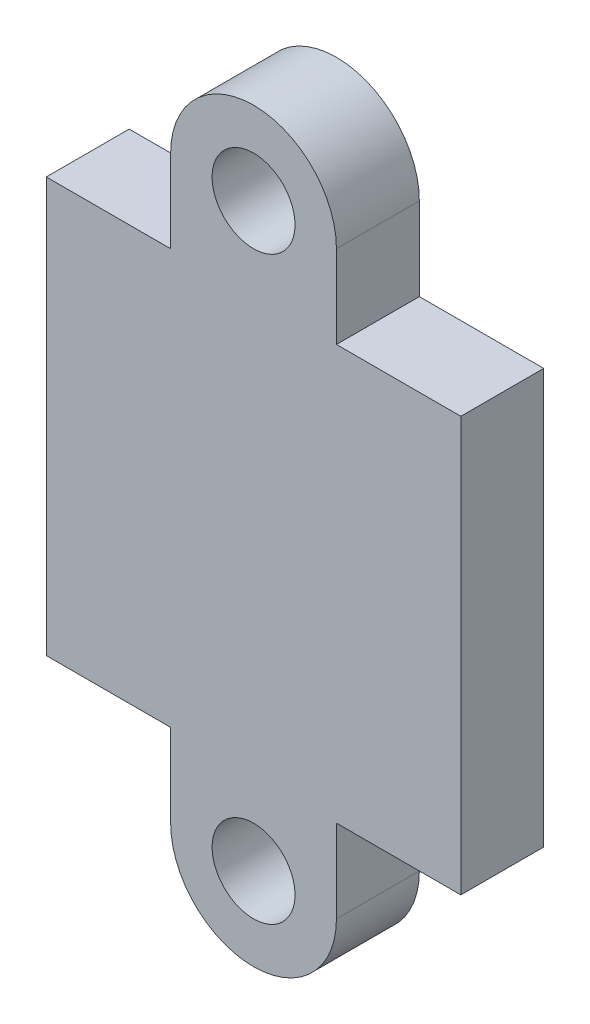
SolidWorks part; units mm, degrees
ref_plane "Front Plane" through (0, 0, 0) normal (0, 0, 1) x (1, 0, 0)
ref_plane "Top Plane" through (0, 0, 0) normal (0, 1, 0) x (1, 0, 0)
ref_plane "Right Plane" through (0, 0, 0) normal (1, 0, 0) x (0, 0, -1)
sketch "Sketch1" plane through (0, 0, 0) normal (0, 0, 1) x (1, 0, 0)
  line L0 (0, -50) -> (0, 50)
  line L1 (0, 50) -> (30, 50)
  line L2 (30, 50) -> (30, 70)
  line L3 (70, 70) -> (70, 50)
  line L4 (70, 50) -> (100, 50)
  line L5 (100, 50) -> (100, -50)
  line L6 (100, 0) -> (0, 0) construction
  line L7 (70, -50) -> (100, -50)
  line L8 (70, -70) -> (70, -50)
  line L9 (30, -50) -> (30, -70)
  line L10 (0, -50) -> (30, -50)
  arc A0 (30, 70) -> (70, 70) centre (50, 70) cw
  circle A1 centre (50, 70) radius 10
  circle A2 centre (50, -70) radius 10
  arc A3 (30, -70) -> (70, -70) centre (50, -70) ccw
  dimension "D3" = 20
  dimension "D4" = 20
  dimension "D1" = 100
  dimension "D2" = 50
  dimension "D5" = 70
extrude "Extrude1" add sketch "Sketch1" along normal mid plane 20
